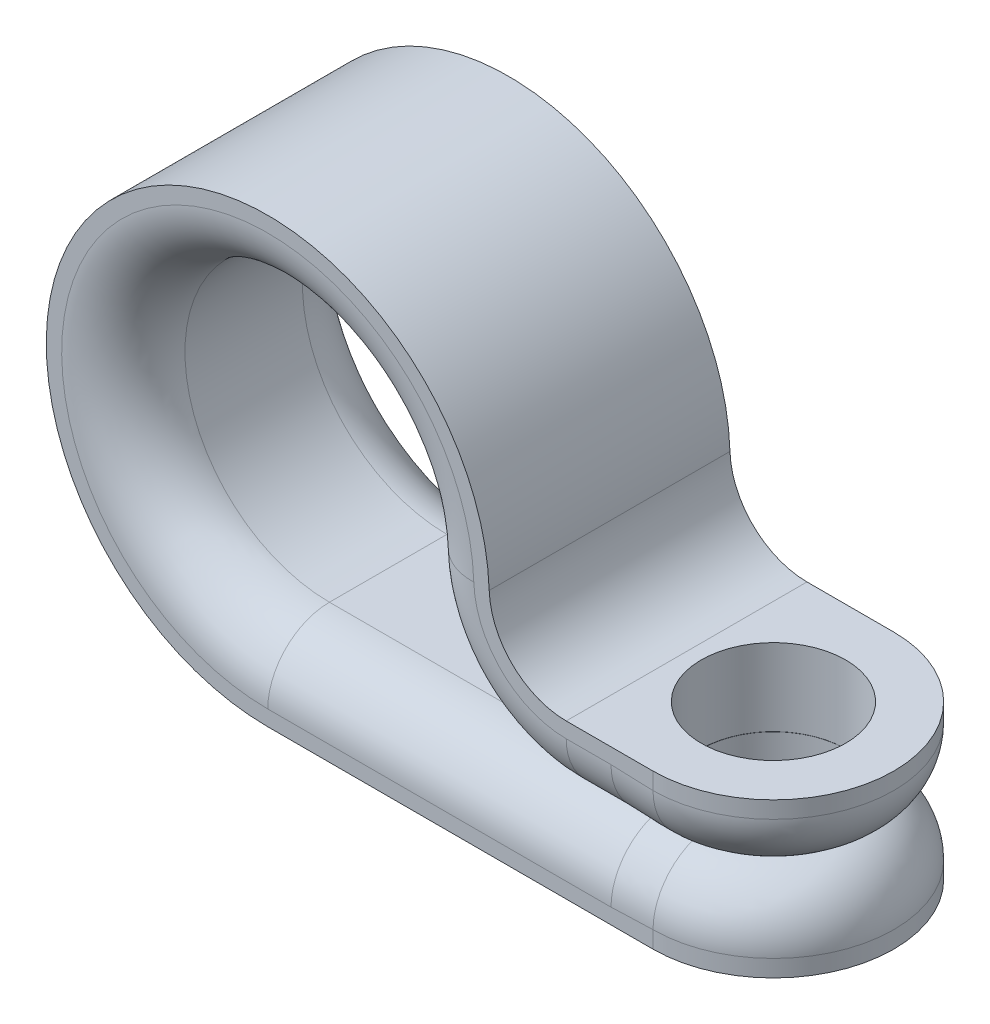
SolidWorks part; units mm, degrees
ref_plane "Front" through (0, 0, 0) normal (0, 0, 1) x (1, 0, 0)
ref_plane "Top" through (0, 0, 0) normal (0, 1, 0) x (1, 0, 0)
ref_plane "Right" through (0, 0, 0) normal (1, 0, 0) x (0, 0, -1)
sketch "Sketch1" plane through (0, 0, 0) normal (0, 0, 1) x (1, 0, 0)
  line L0 (0, -2.3812) -> (8.3344, -2.3813)
  line L2 (4.9186, -2.3787) -> (8.3344, -2.3787)
  line L3 (2.3812, 0) -> (2.3813, -0.5388) construction
  line L4 (4.9186, -1.1087) -> (8.3344, -1.1087)
  line L6 (0, -3.6513) -> (8.3344, -3.6513)
  line L7 (8.3344, -1.1087) -> (8.3344, -2.3787)
  line L8 (8.3344, -2.3813) -> (8.3344, -3.6513)
  line L9 (3.6513, -1.1087) -> (8.3344, -1.1087) construction
  line L10 (3.6513, 0) -> (3.6513, -1.1087) construction
  line L12 (0.761, -2.3787) -> (8.3344, -2.3787) construction
  arc A0 (3.6493, 0.1197) -> (4.9186, -1.1087) centre (4.9186, 0.1613) ccw
  arc A1 (2.38, 0.078) -> (4.9186, -2.3787) centre (4.9186, 0.1613) ccw
  circle A2 centre (6.35, -2.3787) radius 1.1906 construction
  arc A4 (3.6513, 0) -> (0, -3.6513) centre (0, 0) ccw construction
  arc A5 (3.6493, 0.1197) -> (0, -3.6513) centre (0, 0) ccw
  circle A6 centre (0, 0) radius 2.3813 construction
  arc A7 (2.38, 0.078) -> (0, -2.3812) centre (0, 0) ccw
  arc A8 (2.3812, 0) -> (0, -2.3812) centre (0, 0) ccw construction
  arc A9 (0.761, -2.3787) -> (2.3813, -0.5388) centre (10.9096, -9.6824) cw construction
  arc A10 (3.6513, -1.1087) -> (3.6513, -1.1087) centre (3.6513, -1.1087) cw construction
extrude "Boss-Extrude1" add sketch "Sketch1" along normal mid plane 3.9688
sketch "Sketch2" plane through (0, 0, 0) normal (0, 1, 0) x (1, 0, 0)
  circle A0 centre (6.35, 0) radius 1.1906
extrude "Cut-Extrude1" cut sketch "Sketch2" against normal through all
sketch "Sketch4" plane through (0, 0, 0) normal (0, 1, 0) x (1, 0, 0)
  line L0 (8.3344, 1.9844) -> (4.9186, 1.9844) construction
  line L1 (8.3344, -1.9844) -> (4.9186, -1.9844) construction
  line L2 (8.3344, -1.9844) -> (8.3344, 1.9844) construction
  arc A0 (6.35, 1.9844) -> (6.35, -1.9844) centre (6.35, 0) cw
extrude "Cut-Extrude3" cut sketch "Sketch4" against normal through all and the other way through all
sketch "Ref1" plane through (0, 0, 0) normal (0, 1, 0) x (1, 0, 0)
  line L0 (0, 2.3813) -> (0, -2.3813)
sketch "Ref2" plane through (0, 0, 0) normal (0, 0, 1) x (1, 0, 0)
  line L0 (2.3813, 0) -> (2.3813, -2.3813)
  line L1 (2.3813, -2.3813) -> (0, -2.3813)
  circle A0 centre (0, 0) radius 2.3813 construction
  arc A1 (2.3813, 0) -> (0, -2.3813) centre (0, 0) ccw
  point P2 (2.3813, -0.5388)
fillet "Fillet1" radius 1.016 8 edges at (3.175, -2.3812, -1.9844) (-1.7112, 1.656, -1.9844) (5.6343, -2.3787, -1.9844) (5.6343, -2.3787, 1.9844) (-1.7112, 1.656, 1.9844) (3.175, -2.3812, 1.9844) (3.1522, -1.664, -1.9844) (3.1522, -1.664, 1.9844)
equation "\"D1@Sketch1\" = \"Thickness@Sketch1\""
equation "\"D1@Sketch2\" = \"Hole Dia@Sketch1\""
equation "\"D1@Ref1\" = \"Wd@Boss-Extrude1\" * 1.2"
equation "\"Tail@Sketch1\" = \"Wd@Boss-Extrude1\" * .5"
